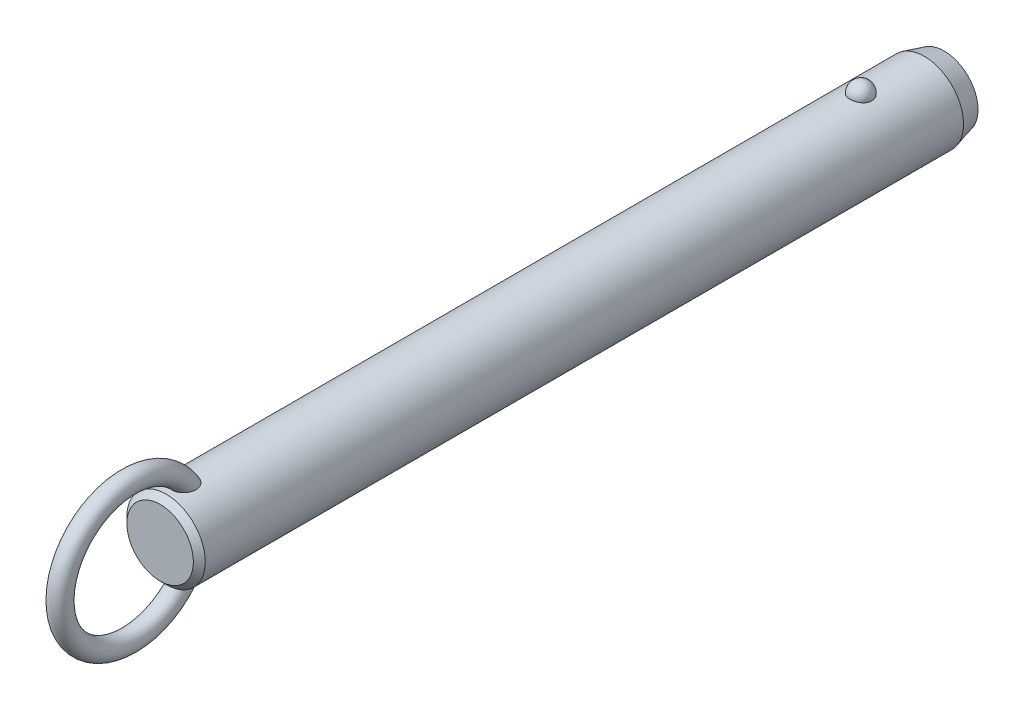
SolidWorks part; units mm, degrees
ref_plane "Front Plane" through (0, 0, 0) normal (0, 0, 1) x (1, 0, 0)
ref_plane "Top Plane" through (0, 0, 0) normal (0, 1, 0) x (1, 0, 0)
ref_plane "Right Plane" through (0, 0, 0) normal (1, 0, 0) x (0, 0, -1)
sketch "Sketch2" plane through (0, 0, 0) normal (0, 0, 1) x (1, 0, 0)
  circle A0 centre (0, 0) radius 7.9
  point P3 (0, 7.9)
  dimension "D1" = 15.8
extrude "Boss-Extrude1" add sketch "Sketch2" along normal blind 129.5
sketch "Sketch3" plane through (0, 0, 0) normal (0, 0, -1) x (-1, 0, 0)
  circle A0 centre (0, 0) radius 7.9
  dimension "D1" = 15.8
extrude "Boss-Extrude2" add sketch "Sketch3" along normal blind 19
chamfer "Chamfer1" distance 4 angle 15 1 edges at (-7.9, 0, -19)
sketch "Sketch12" plane through (0, 0, 0) normal (1, 0, 0) x (0, 0, -1)
  line L0 (-129.5, 7.9) -> (-129.5, -7.9) construction
  point P0 (-129.5, 0)
sketch "Sketch13" plane through (0, 0, 0) normal (1, 0, 0) x (0, 0, -1)
  circle A0 centre (-145.35, 0) radius 15.85
  point P2 (-129.5, 0)
  dimension "D1" = 31.7
sketch "Sketch14" plane through (0, 0, 0) normal (0, 1, 0) x (1, 0, 0)
  circle A0 centre (0, -131.5) radius 2
  point P2 (0, -129.5)
  dimension "D1" = 4
sweep "Sweep1" add profiles "Sketch14" path "Sketch13"
sketch "Sketch15" plane through (0, 0, 129.5) normal (0, 0, 1) x (1, 0, 0)
  circle A0 centre (0, 0) radius 7.9
  dimension "D1" = 15.8
extrude "Boss-Extrude3" add sketch "Sketch15" along normal blind 9.52
chamfer "Chamfer2" distance 1.2 angle 45 1 edges at (7.9, 0, 139.02)
sketch "Sketch18" plane through (0, 0, 0) normal (1, 0, 0) x (0, 0, -1)
  line L0 (15, 7.9) -> (-131.6091, 7.9) construction
  line L1 (2.2, 10.1) -> (2.2, 5.7)
  line L2 (-131.6091, -7.9) -> (15, -7.9) construction
  arc A0 (2.2, 10.1) -> (2.2, 5.7) centre (2.2, 7.9) ccw
  point P4 (0, 7.9)
  dimension "D1" = 18
revolve "Revolve1" add sketch "Sketch18" angle 360 about L1
